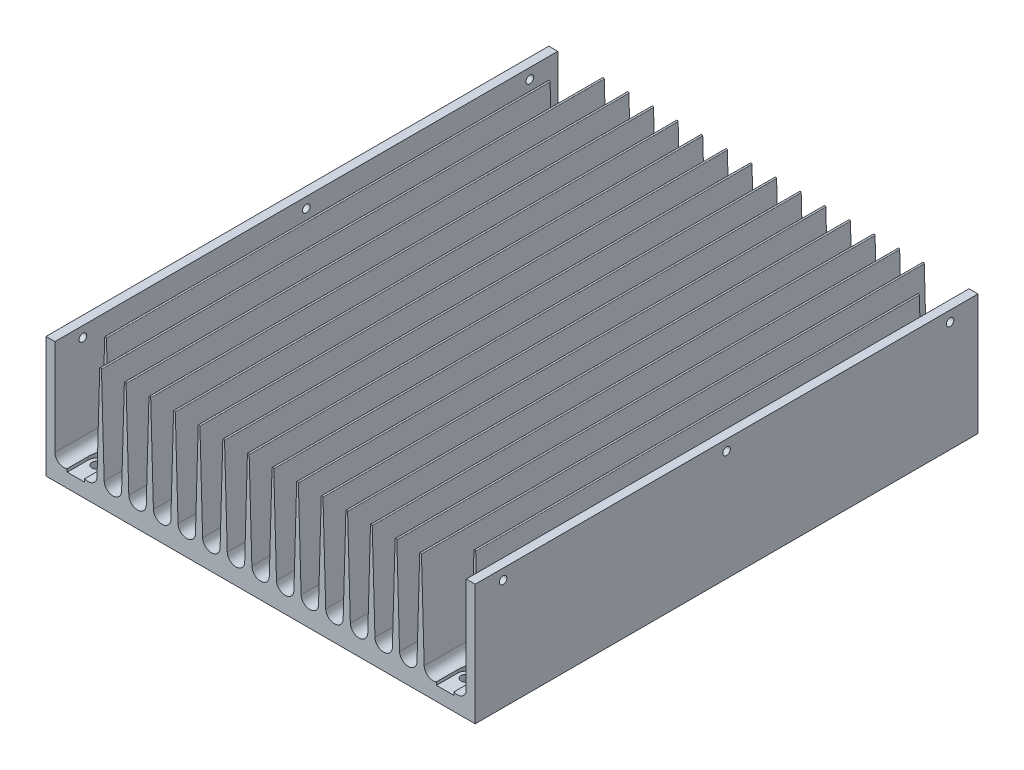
SolidWorks part; units mm, degrees
ref_plane "Front" through (0, 0, 0) normal (0, 0, 1) x (1, 0, 0)
ref_plane "Top" through (0, 0, 0) normal (0, 1, 0) x (1, 0, 0)
ref_plane "Right" through (0, 0, 0) normal (1, 0, 0) x (0, 0, -1)
sketch "Sketch1" plane through (0, 0, 0) normal (0, 0, 1) x (1, 0, 0)
  line L0 (-97.5614, 54.991) -> (-97.5614, 0)
  line L1 (-97.5614, 0) -> (97.5614, 0)
  line L2 (0, 0) -> (0, 81172.2513) construction
  line L3 (-97.5614, 54.991) -> (-93.4974, 54.991)
  line L4 (-93.4974, 54.991) -> (-93.4974, 11.3856)
  line L5 (-85.5615, 11.2728) -> (-84.3298, 54.6054)
  line L6 (-83.5364, 54.6054) -> (-82.3047, 11.2728)
  line L7 (-74.3704, 11.2728) -> (-73.1387, 54.6054)
  line L8 (-72.3453, 54.6054) -> (-71.1136, 11.2728)
  line L9 (-63.1793, 11.2728) -> (-61.9477, 54.6054)
  line L10 (-61.1542, 54.6054) -> (-59.9226, 11.2728)
  line L11 (-51.9883, 11.2728) -> (-50.7566, 54.6054)
  line L12 (-49.9632, 54.6054) -> (-48.7315, 11.2728)
  line L13 (-40.7972, 11.2728) -> (-39.5655, 54.6054)
  line L14 (-38.7721, 54.6054) -> (-37.5404, 11.2728)
  line L15 (-29.6061, 11.2728) -> (-28.3744, 54.6054)
  line L16 (-27.581, 54.6054) -> (-26.3493, 11.2728)
  line L17 (-18.415, 11.2728) -> (-17.1833, 54.6054)
  line L18 (-16.3899, 54.6054) -> (-15.1582, 11.2728)
  line L19 (-7.2239, 11.2728) -> (-5.9923, 54.6054)
  line L20 (-5.1988, 54.6054) -> (-3.9671, 11.2728)
  line L21 (5.1988, 54.6054) -> (3.9671, 11.2728)
  line L22 (7.2239, 11.2728) -> (5.9923, 54.6054)
  line L23 (16.3899, 54.6054) -> (15.1582, 11.2728)
  line L24 (18.415, 11.2728) -> (17.1833, 54.6054)
  line L25 (27.581, 54.6054) -> (26.3493, 11.2728)
  line L26 (29.6061, 11.2728) -> (28.3744, 54.6054)
  line L27 (38.7721, 54.6054) -> (37.5404, 11.2728)
  line L28 (40.7972, 11.2728) -> (39.5655, 54.6054)
  line L29 (49.9632, 54.6054) -> (48.7315, 11.2728)
  line L30 (51.9883, 11.2728) -> (50.7566, 54.6054)
  line L31 (61.1542, 54.6054) -> (59.9226, 11.2728)
  line L32 (63.1793, 11.2728) -> (61.9477, 54.6054)
  line L33 (72.3453, 54.6054) -> (71.1136, 11.2728)
  line L34 (74.3704, 11.2728) -> (73.1387, 54.6054)
  line L35 (83.5364, 54.6054) -> (82.3047, 11.2728)
  line L36 (85.5615, 11.2728) -> (84.3298, 54.6054)
  line L37 (93.4974, 54.991) -> (93.4974, 11.3856)
  line L38 (97.5614, 54.991) -> (93.4974, 54.991)
  line L39 (97.5614, 54.991) -> (97.5614, 0)
  arc A0 (-93.4974, 11.3856) -> (-85.5615, 11.2728) centre (-89.5287, 11.3856) ccw
  arc A1 (-84.3298, 54.6054) -> (-83.5364, 54.6054) centre (-83.9331, 54.5941) cw
  arc A2 (-82.3047, 11.2728) -> (-74.3704, 11.2728) centre (-78.3376, 11.3855) ccw
  arc A3 (-73.1387, 54.6054) -> (-72.3453, 54.6054) centre (-72.742, 54.5941) cw
  arc A4 (-71.1136, 11.2728) -> (-63.1793, 11.2728) centre (-67.1465, 11.3855) ccw
  arc A5 (-61.9477, 54.6054) -> (-61.1542, 54.6054) centre (-61.5509, 54.5941) cw
  arc A6 (-59.9226, 11.2728) -> (-51.9883, 11.2728) centre (-55.9554, 11.3855) ccw
  arc A7 (-50.7566, 54.6054) -> (-49.9632, 54.6054) centre (-50.3599, 54.5941) cw
  arc A8 (-48.7315, 11.2728) -> (-40.7972, 11.2728) centre (-44.7643, 11.3855) ccw
  arc A9 (-39.5655, 54.6054) -> (-38.7721, 54.6054) centre (-39.1688, 54.5941) cw
  arc A10 (-37.5404, 11.2728) -> (-29.6061, 11.2728) centre (-33.5732, 11.3855) ccw
  arc A11 (-28.3744, 54.6054) -> (-27.581, 54.6054) centre (-27.9777, 54.5941) cw
  arc A12 (-26.3493, 11.2728) -> (-18.415, 11.2728) centre (-22.3822, 11.3855) ccw
  arc A13 (-17.1833, 54.6054) -> (-16.3899, 54.6054) centre (-16.7866, 54.5941) cw
  arc A14 (-15.1582, 11.2728) -> (-7.2239, 11.2728) centre (-11.1911, 11.3855) ccw
  arc A15 (-5.9923, 54.6054) -> (-5.1988, 54.6054) centre (-5.5955, 54.5941) cw
  arc A16 (-3.9671, 11.2728) -> (3.9671, 11.2728) centre (0, 11.3855) ccw
  arc A17 (5.9923, 54.6054) -> (5.1988, 54.6054) centre (5.5955, 54.5941) ccw
  arc A18 (15.1582, 11.2728) -> (7.2239, 11.2728) centre (11.1911, 11.3855) cw
  arc A19 (17.1833, 54.6054) -> (16.3899, 54.6054) centre (16.7866, 54.5941) ccw
  arc A20 (26.3493, 11.2728) -> (18.415, 11.2728) centre (22.3822, 11.3855) cw
  arc A21 (28.3744, 54.6054) -> (27.581, 54.6054) centre (27.9777, 54.5941) ccw
  arc A22 (37.5404, 11.2728) -> (29.6061, 11.2728) centre (33.5732, 11.3855) cw
  arc A23 (39.5655, 54.6054) -> (38.7721, 54.6054) centre (39.1688, 54.5941) ccw
  arc A24 (48.7315, 11.2728) -> (40.7972, 11.2728) centre (44.7643, 11.3855) cw
  arc A25 (50.7566, 54.6054) -> (49.9632, 54.6054) centre (50.3599, 54.5941) ccw
  arc A26 (59.9226, 11.2728) -> (51.9883, 11.2728) centre (55.9554, 11.3855) cw
  arc A27 (61.9477, 54.6054) -> (61.1542, 54.6054) centre (61.5509, 54.5941) ccw
  arc A28 (71.1136, 11.2728) -> (63.1793, 11.2728) centre (67.1465, 11.3855) cw
  arc A29 (73.1387, 54.6054) -> (72.3453, 54.6054) centre (72.742, 54.5941) ccw
  arc A30 (82.3047, 11.2728) -> (74.3704, 11.2728) centre (78.3376, 11.3855) cw
  arc A31 (84.3298, 54.6054) -> (83.5364, 54.6054) centre (83.9331, 54.5941) ccw
  arc A32 (93.4974, 11.3856) -> (85.5615, 11.2728) centre (89.5287, 11.3856) cw
  point P120 (0, 0)
  dimension "D3" = 7.4168
  dimension "D5" = 3.9688
  dimension "D6" = 0.3969
  dimension "D2" = 195.1228
  dimension "D4" = 4.064
  dimension "D7" = 54.991
  dimension "D1" = 8
extrude "Boss-Extrude1" add sketch "Sketch1" along normal mid plane 228.6
hole_wizard "CBORE for #8 Socket Head Cap Screw1" positions "Sketch2" profile "Sketch3" counterbore size "#8" standard "ANSI Inch"
sketch "Sketch2" plane through (0, 54.991, 0) normal (0, 1, 0) x (1, 0, 0)
  line L0 (-83.9331, 114.3) -> (-83.9331, 104.775) construction
  line L1 (-83.5364, 114.3) -> (-84.3298, 114.3) construction
  line L3 (0, 0) -> (50000, 0) construction
  line L4 (0, 0) -> (0, -50000) construction
  point P0 (-83.9331, 104.775)
  point P15 (83.9331, 104.775)
  point P16 (83.9331, -104.775)
  point P17 (-83.9331, -104.775)
  dimension "D1" = 209.55
sketch "Sketch3" plane through (-83.9331, 54.991, -104.775) normal (1, 0, 0) x (0, 0, 1)
  line L0 (0, 0) -> (0, 54.991)
  line L1 (0, 54.991) -> (2.2479, 54.991)
  line L3 (2.2479, 54.991) -> (2.2479, 48.6156)
  line L4 (2.2479, 48.6156) -> (3.9687, 48.6156)
  line L5 (3.9687, 48.6156) -> (3.9687, 0)
  line L7 (3.9687, 0) -> (0, 0)
  line L11 (0, -6.35) -> (0, 107.95) construction
  dimension "Thru Hole Dia." = 4.4958
  dimension "Thru Hole Depth" = 54.991
  dimension "C'Bore Dia." = 7.9375
  dimension "C'Bore Depth" = 48.6156
sketch "Sketch4" plane through (0, 0, -114.3) normal (0, 0, -1) x (-1, 0, 0)
  line L1 (79.9644, 6.3754) -> (87.9019, 6.3754)
  line L2 (79.9644, 6.3754) -> (79.9644, 54.991)
  line L3 (79.9644, 54.991) -> (87.9019, 54.991)
  line L4 (87.9019, 6.3754) -> (87.9019, 54.991)
  line L5 (0, 0) -> (0, -50000) construction
  line L6 (97.5614, 0) -> (-97.5614, 0) construction
  line L7 (93.4974, 54.991) -> (97.5614, 54.991) construction
  line L8 (87.9019, 6.3754) -> (79.9644, 6.3754) construction
  line L9 (87.9019, 6.3754) -> (87.9019, 7.7655) construction
  point P11 (0, 0)
extrude "Cut-Extrude2" cut sketch "Sketch4" against normal up to vertex (9.525 mm away)
mirror "Mirror1" about plane through (0, 0, 0) normal (1, 0, 0) of "Cut-Extrude2"
mirror "Mirror2" about plane through (0, 0, 0) normal (0, 0, 1) of "Mirror1", "Cut-Extrude2"
hole_wizard "#8-32 Tapped Hole1" positions "Sketch5" profile "Sketch6" tap size "#8-32" standard "ANSI Inch"
sketch "Sketch5" plane through (97.5614, 0, 0) normal (1, 0, 0) x (0, 0, -1)
  line L1 (0, 0) -> (0, 54.991) construction
  line L2 (-114.3, 54.991) -> (114.3, 54.991) construction
  point P0 (-101.6, 50.2285)
  point P14 (101.6, 50.2285)
  point P15 (0, 50.2285)
  dimension "D1" = 4.7625
  dimension "D2" = 203.2
sketch "Sketch6" plane through (97.5614, 50.2285, 101.6) normal (0, 1, 0) x (0, 0, -1)
  line L0 (0, 0) -> (0, 25.3405)
  line L1 (0, 25.3405) -> (1.7272, 25.3405)
  line L2 (1.7272, 25.3405) -> (1.7272, 0)
  line L5 (1.7272, 0) -> (0, 0)
  line L11 (0, -6.35) -> (0, 107.95) construction
  dimension "Thru Tap Drill Dia." = 3.4544
  dimension "Thru Tap Drill Depth" = 25.3405
mirror "Mirror3" about plane through (0, 0, 0) normal (1, 0, 0) of "#8-32 Tapped Hole1"
